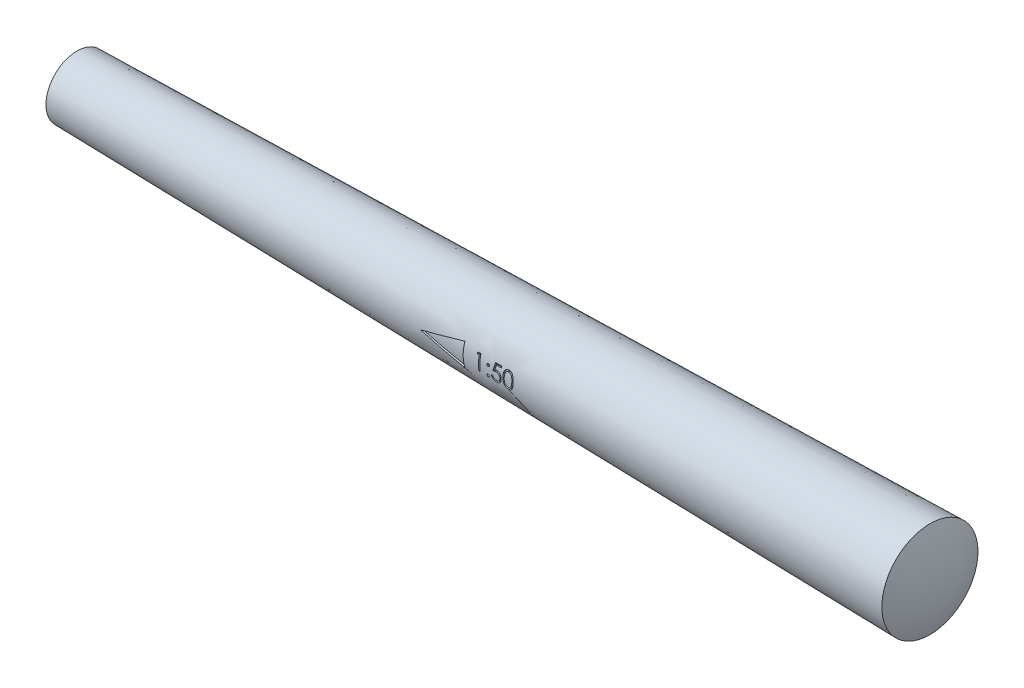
SolidWorks part; units mm, degrees
ref_plane "Front Plane" through (0, 0, 0) normal (0, 0, 1) x (1, 0, 0)
ref_plane "Top Plane" through (0, 0, 0) normal (0, 1, 0) x (1, 0, 0)
ref_plane "Right Plane" through (0, 0, 0) normal (1, 0, 0) x (0, 0, -1)
sketch "Sketch1" plane through (0, 0, 0) normal (1, 0, 0) x (0, 0, -1)
  circle A0 centre (0, 0) radius 2
  dimension "D1" = 4
extrude "Extrude1" add sketch "Sketch1" along normal mid plane 55
draft "Draft1" type of draft neutral plane draft angle 1.146 faces to draft 1 parameters "D1"=1.146
sketch "Sketch2" plane through (0, 0, 0) normal (0, 0, 1) x (1, 0, 0)
  line L0 (-27.5, 0) -> (-27.5, 2)
  line L1 (-27.5, 2) -> (-27.5, -2) construction
  line L2 (-27.5, 0) -> (-28.1, 0)
  line L3 (-28.1, 0) -> (-28.1, -2.55) construction
  line L4 (27.5, 0) -> (27.5, 3.1)
  line L5 (27.5, -3.1) -> (27.5, 3.1) construction
  line L6 (27.5, 0) -> (28.1, 0)
  line L7 (28.1, 0) -> (28.1, -2.55) construction
  line L8 (-27.5, -2) -> (27.5, -3.1) construction
  arc A0 (-28.1, 0) -> (-27.5, 2) centre (-24.4667, 0) cw
  arc A1 (28.1, 0) -> (27.5, 3.1) centre (19.7915, 0) ccw
  point P14 (0, -2.55)
revolve "Revolve1" add sketch "Sketch2" angle 360 about L2
sketch "Sketch5" plane through (0, 0, 0) normal (0, 0, 1) x (1, 0, 0)
  line L0 (0, 2.55) -> (0, -2.55) construction
  line L1 (27.5, 3.1) -> (-27.5, 2) construction
  line L2 (-27.5, -2) -> (27.5, -3.1) construction
ref_plane "Plane2" through (0, 0, 0) normal (-0.02, 0, 0.9998) x (0.9998, 0, 0.02)
sketch "Sketch6" plane through (0, 0, 0) normal (-0.02, 0, 0.9998) x (0.9998, 0, 0.02)
  line L0 (0, 0) -> (0, 0.75)
  line L1 (0, 2.55) -> (0, -2.55) construction
  line L2 (0, 0.75) -> (-2.799, 0)
  line L3 (-2.799, 0) -> (0, -0.75)
  line L4 (0, -0.75) -> (0, 0)
  line L5 (0, -0.375) -> (4, -0.375) construction
  text T0 "1:50" font "Century Gothic" height 1
  dimension "D1" = 1.5
  dimension "D2" = 30
  dimension "D3" = 4
wrap "Wrap2" sketch "Sketch6" wrap type deboss source sketch "Sketch6" thickness 0.1 parameters "D1"=0.1
equation "\"D2@Sketch2\" = \"D1@Sketch2\""
